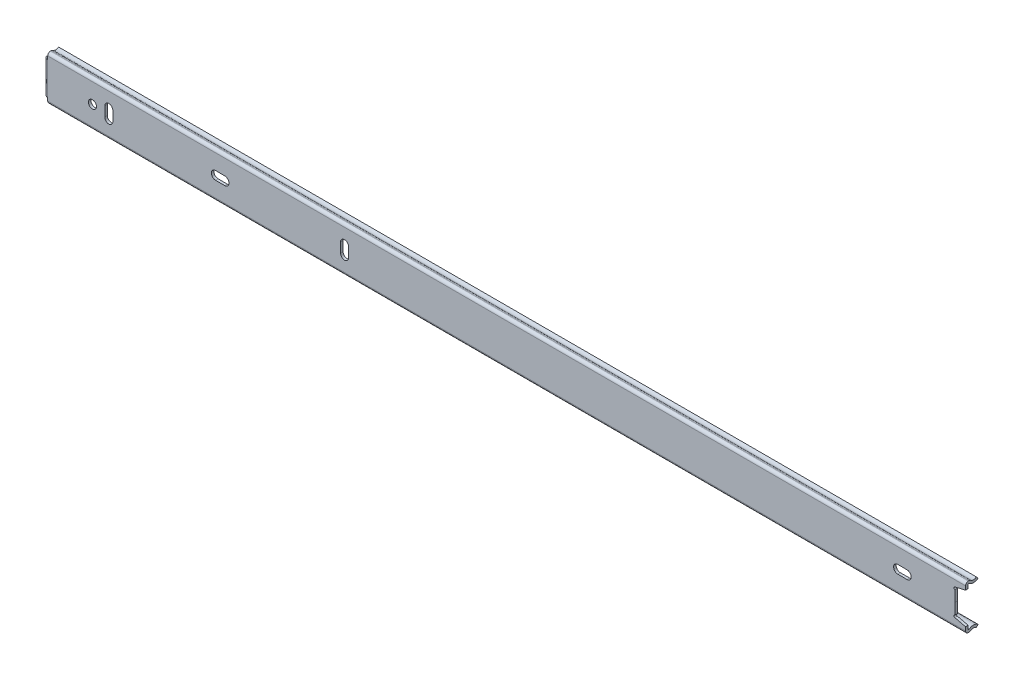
SolidWorks part; units mm, degrees
ref_plane "Front Plane" through (0, 0, 0) normal (0, 0, 1) x (1, 0, 0)
ref_plane "Top Plane" through (0, 0, 0) normal (0, 1, 0) x (1, 0, 0)
ref_plane "Right Plane" through (0, 0, 0) normal (1, 0, 0) x (0, 0, -1)
imported_body "Imported3"
sketch "Sketch1" plane through (0, 0, 5.1208) normal (0, 0, -1) x (-1, 0, 0)
  line L0 (756.158, -10.7505) -> (756.158, 10.7505)
  line L1 (756.158, 10.7505) -> (257.937, 10.7505)
  line L2 (257.937, 10.7505) -> (257.937, 8.5893)
  line L3 (257.937, 8.5893) -> (263.7963, 7.2212)
  line L4 (263.6519, 5.9678) -> (263.6519, 0)
  line L5 (263.6519, 0) -> (263.6519, -5.9678)
  line L6 (263.7963, -7.2212) -> (257.937, -8.5893)
  line L7 (257.937, -8.5893) -> (257.937, -10.7505)
  line L8 (257.937, -10.7505) -> (756.158, -10.7505)
  line L9 (756.158, -10.7505) -> (756.158, 10.7505) construction
  line L10 (257.937, 10.7505) -> (756.158, 10.7505) construction
  arc A0 (263.7963, 7.2212) -> (263.6519, 5.9678) centre (263.6519, 6.6028) cw
  arc A1 (263.6519, -5.9678) -> (263.7963, -7.2212) centre (263.6519, -6.6028) cw
  dimension "D1" = 0.635
  dimension "D2" = 0.635
  dimension "D3" = 492.3617
  dimension "D4" = 492.5061
  dimension "D5" = 498.221
  dimension "D6" = 2.1612
  dimension "D7" = 16.7183
  dimension "D8" = 21.501
  dimension "D10" = 10.7505
extrude "Cut-Extrude1" cut sketch "Sketch1" against normal blind 0.5434
sketch "Sketch2" plane through (-756.158, 0, 0) normal (-1, 0, 0) x (0, 0, 1)
  line L0 (5.6642, 8.89) -> (7.0612, 8.89)
  line L1 (7.0612, 8.89) -> (7.0612, -8.89)
  line L2 (7.0612, -8.89) -> (5.6642, -8.89)
  line L3 (5.6642, -8.89) -> (5.6642, 8.89)
  line L4 (4.5743, -12.1475) -> (7.0612, -12.1475) construction
  line L5 (5.6642, -10.7505) -> (5.6642, 10.7505) construction
  dimension "D1" = 1.397
  dimension "D2" = 3.2575
  dimension "D3" = 21.0375
extrude "Boss-Extrude1" add sketch "Sketch2" along normal blind 1.905
sketch "Sketch3" plane through (0, 0, 5.6642) normal (0, 0, -1) x (-1, 0, 0)
  line L0 (758.063, 8.89) -> (758.063, -8.89)
  line L1 (758.063, -8.89) -> (756.666, -8.89)
  line L2 (756.666, -8.89) -> (756.666, 8.89)
  line L3 (756.666, 8.89) -> (758.063, 8.89)
  line L4 (257.937, -8.5893) -> (257.937, -10.7505) construction
  line L5 (257.937, -10.7505) -> (756.158, -10.7505) construction
  dimension "D1" = 498.729
  dimension "D2" = 500.126
  dimension "D3" = 1.8605
  dimension "D4" = 19.6405
extrude "Boss-Extrude2" add sketch "Sketch3" along normal blind 5.3601
sketch "Sketch4" plane through (0, 0, 5.6642) normal (0, 0, -1) x (-1, 0, 0)
  line L0 (660.0825, -2.286) -> (665.0355, -2.286)
  line L1 (665.0355, 2.286) -> (660.0825, 2.286)
  line L2 (257.937, 10.7505) -> (257.937, 8.5893) construction
  line L3 (756.158, 10.7505) -> (257.937, 10.7505) construction
  arc A0 (660.0825, 2.286) -> (660.0825, -2.286) centre (660.0825, 0) ccw
  arc A1 (665.0355, -2.286) -> (665.0355, 2.286) centre (665.0355, 0) ccw
  dimension "D1" = 2.286
  dimension "D2" = 402.1455
  dimension "D3" = 407.0985
  dimension "D4" = 10.7505
extrude "Cut-Extrude2" cut sketch "Sketch4" against normal through all
sketch "Sketch5" plane through (0, 0, 5.6642) normal (0, 0, -1) x (-1, 0, 0)
  line L0 (720.8266, 2.6416) -> (720.8266, -2.6416)
  line L1 (725.1954, -2.6416) -> (725.1954, 2.6416)
  line L2 (257.937, 10.7505) -> (257.937, 8.5893) construction
  line L3 (756.158, 10.7505) -> (257.937, 10.7505) construction
  arc A0 (720.8266, -2.6416) -> (725.1954, -2.6416) centre (723.011, -2.6416) ccw
  arc A1 (725.1954, 2.6416) -> (720.8266, 2.6416) centre (723.011, 2.6416) ccw
  dimension "D1" = 2.1844
  dimension "D2" = 465.074
  dimension "D3" = 8.1089
  dimension "D4" = 13.3921
extrude "Cut-Extrude3" cut sketch "Sketch5" against normal through all
sketch "Sketch6" plane through (0, 0, 5.6642) normal (0, 0, -1) x (-1, 0, 0)
  line L0 (289.7505, -2.286) -> (294.7035, -2.286)
  line L1 (294.7035, 2.286) -> (289.7505, 2.286)
  line L2 (756.666, 8.89) -> (756.666, -8.89) construction
  line L3 (756.158, 10.7505) -> (257.937, 10.7505) construction
  arc A0 (289.7505, 2.286) -> (289.7505, -2.286) centre (289.7505, 0) ccw
  arc A1 (294.7035, -2.286) -> (294.7035, 2.286) centre (294.7035, 0) ccw
  dimension "D1" = 2.286
  dimension "D2" = 461.9625
  dimension "D3" = 466.9155
  dimension "D4" = 10.7505
extrude "Cut-Extrude4" cut sketch "Sketch6" against normal through all
sketch "Sketch7" plane through (0, 0, 7.0612) normal (0, 0, 1) x (1, 0, 0)
  line L0 (-592.8266, -2.6416) -> (-592.8266, 2.6416)
  line L1 (-597.1954, 2.6416) -> (-597.1954, -2.6416)
  line L2 (-756.158, -12.1475) -> (-756.158, -8.89) construction
  line L3 (-257.937, -12.1475) -> (-756.158, -12.1475) construction
  arc A0 (-592.8266, 2.6416) -> (-597.1954, 2.6416) centre (-595.011, 2.6416) ccw
  arc A1 (-597.1954, -2.6416) -> (-592.8266, -2.6416) centre (-595.011, -2.6416) ccw
  dimension "D1" = 2.1844
  dimension "D2" = 161.147
  dimension "D3" = 9.5059
  dimension "D4" = 14.7891
extrude "Cut-Extrude5" cut sketch "Sketch7" against normal through all
hole_wizard "M4 Clearance Hole1" positions "Sketch9" profile "Sketch8" hole size "M4" standard "ANSI Metric"
sketch "Sketch9" plane through (0, 0, 7.0612) normal (0, 0, 1) x (1, 0, 0)
  point P0 (-731.901, 0)
sketch "Sketch8" plane through (-731.901, 0, 7.0612) normal (1, 0, 0) x (0, -1, 0)
  line L0 (0, 0) -> (0, 6.7571)
  line L1 (0, 6.7571) -> (2.1844, 6.7571)
  line L2 (2.1844, 6.7571) -> (2.1844, 0)
  line L5 (2.1844, 0) -> (0, 0)
  line L11 (0, -6.35) -> (0, 107.95) construction
  dimension "Thru Hole Dia." = 4.3688
  dimension "Thru Hole Depth" = 6.7571
fillet "Fillet1" radius 0.127 4 edges at (-507.0475, 10.7505, 5.6642) (-507.0475, 10.7505, 5.1208) (-507.0475, -10.7505, 5.6642) (-507.0475, -10.7505, 5.1208)
fillet "Fillet2" radius 0.254 1 edges at (-756.666, 0, 5.6642)
fillet "Fillet3" radius 1.524 4 edges at (-507.0475, 12.1475, 7.0612) (-507.0475, -12.1475, 7.0612) (-507.0475, 12.1475, 4.5743) (-507.0475, -12.1475, 4.5743)
fillet "Fillet4" radius 1.651 1 edges at (-758.063, 0, 7.0612)
